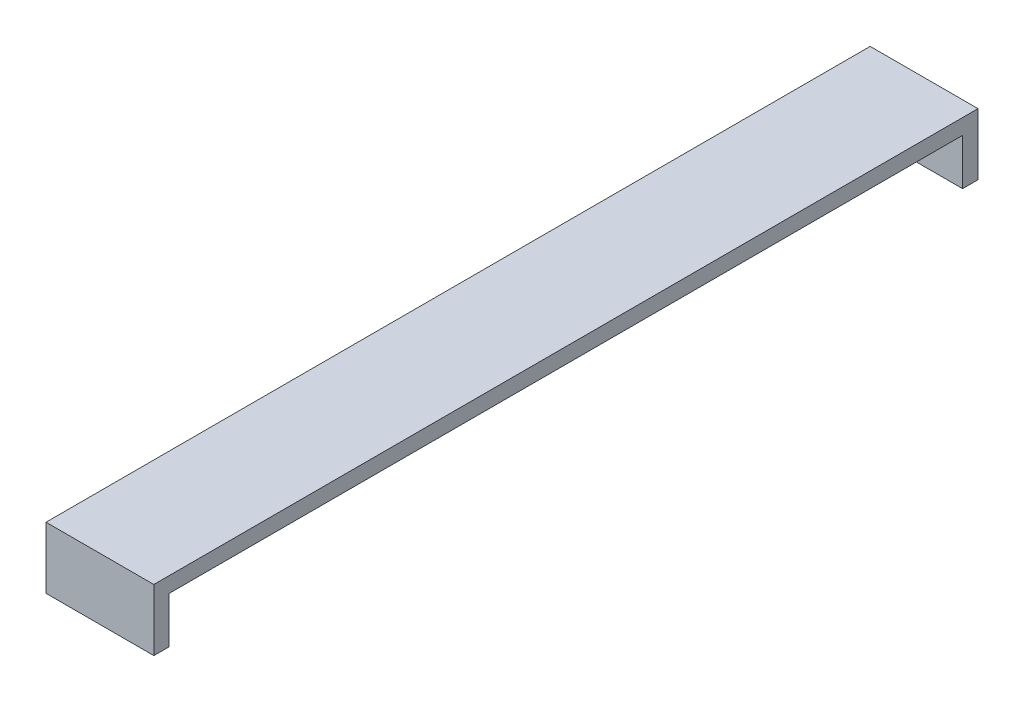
SolidWorks part; units mm, degrees
ref_plane "Přední rovina" through (0, 0, 0) normal (0, 0, 1) x (1, 0, 0)
ref_plane "Horní rovina" through (0, 0, 0) normal (0, 1, 0) x (1, 0, 0)
ref_plane "Pravá rovina" through (0, 0, 0) normal (1, 0, 0) x (0, 0, -1)
sketch "Skica1" plane through (0, 0, 0) normal (0, 0, 1) x (1, 0, 0)
  line L0 (0, 0) -> (30, 0) construction
  line L1 (0, 0) -> (0, 30) construction
  line L2 (-3.5, 0) -> (3.5, 0)
  line L3 (3.5, 0) -> (3.5, 1)
  line L4 (3.5, 1) -> (-3.5, 1)
  line L5 (-3.5, 0) -> (-3.5, 1)
  point P8 (0, 1)
  dimension "D1" = 1
  dimension "D2" = 7
extrude "Přidat vysunutím1" add sketch "Skica1" along normal blind 53.5
sketch "Skica2" plane through (0, 0, 0) normal (0, -1, 0) x (1, 0, 0)
  line L0 (0, 0) -> (0, 53.5) construction
  line L1 (-3.5, 53.5) -> (3.5, 53.5) construction
  line L2 (-3.5, 26.75) -> (3.5, 26.75) construction
  line L3 (-3.5, 53.5) -> (-3.5, 0) construction
  line L4 (3.5, 53.5) -> (3.5, 0) construction
  line L5 (-3.5, 53.5) -> (3.5, 53.5)
  line L6 (3.5, 53.5) -> (3.5, 52.5)
  line L7 (3.5, 52.5) -> (-3.5, 52.5)
  line L8 (-3.5, 52.5) -> (-3.5, 53.5)
  line L9 (-3.5, 1) -> (-3.5, 0)
  line L10 (3.5, 1) -> (-3.5, 1)
  line L11 (3.5, 0) -> (3.5, 1)
  line L12 (-3.5, 0) -> (3.5, 0)
  dimension "D1" = 1
  dimension "D2" = 7
extrude "Přidat vysunutím2" add sketch "Skica2" along normal blind 3
